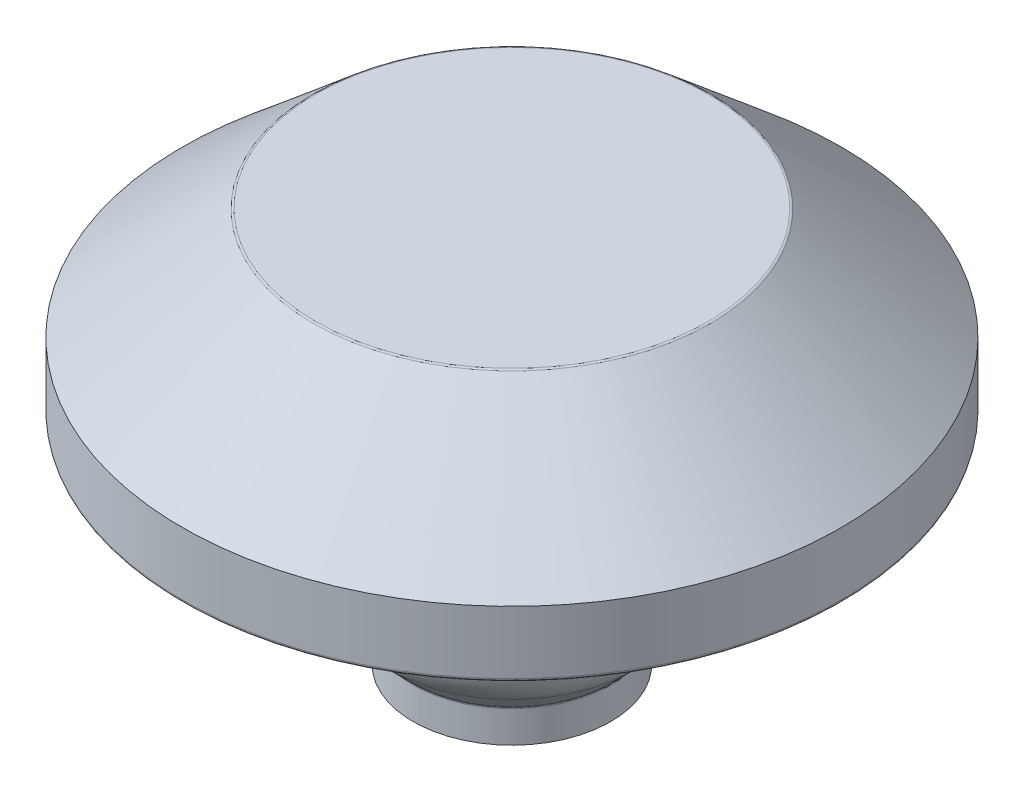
SolidWorks part; units mm, degrees
ref_plane "Front Plane" through (0, 0, 0) normal (0, 0, 1) x (1, 0, 0)
ref_plane "Top Plane" through (0, 0, 0) normal (0, 1, 0) x (1, 0, 0)
ref_plane "Right Plane" through (0, 0, 0) normal (1, 0, 0) x (0, 0, -1)
sketch "Sketch1" plane through (0, 0, 0) normal (0, 0, 1) x (1, 0, 0)
  line L0 (0, 0) -> (0, 2.5819) construction
  line L1 (0, 6) -> (3, 6)
  line L2 (3, 6) -> (5, 4.3)
  line L3 (5, 4.3) -> (5, 3.3)
  line L4 (5, 3.3) -> (4.5, 3.3)
  line L5 (2, 4.8) -> (1.85, 2)
  line L6 (1.5, 0.5) -> (1.5, 0)
  line L7 (1.5, 0) -> (0, 0)
  line L8 (0, 0) -> (0, 6)
  line L9 (1.5, 0.5) -> (1.85, 0.85)
  line L12 (2, 4.8) -> (4.5, 3.3)
  arc A3 (1.85, 2) -> (1.85, 0.85) centre (1.275, 1.425) cw
  dimension "D1" = 3
  dimension "D2" = 2
  dimension "D3" = 10
  dimension "D4" = 6
  dimension "D5" = 2.7
  dimension "D6" = 6
  dimension "D7" = 1
  dimension "D8" = 0.5
  dimension "D9" = 2.8
  dimension "D10" = 3.7
  dimension "D11" = 135
  dimension "D12" = 4
  dimension "D14" = 0.5
revolve "Revolve1" add sketch "Sketch1" angle 360 about L0
fillet "Fillet1" radius 0.05 6 edges at (0, 6, -3) (0, 3.3, -5) (0, 3.3, -4.5) (0, 0.5, -1.5) (0, 2, -1.85) (0, 4.8, -2)
